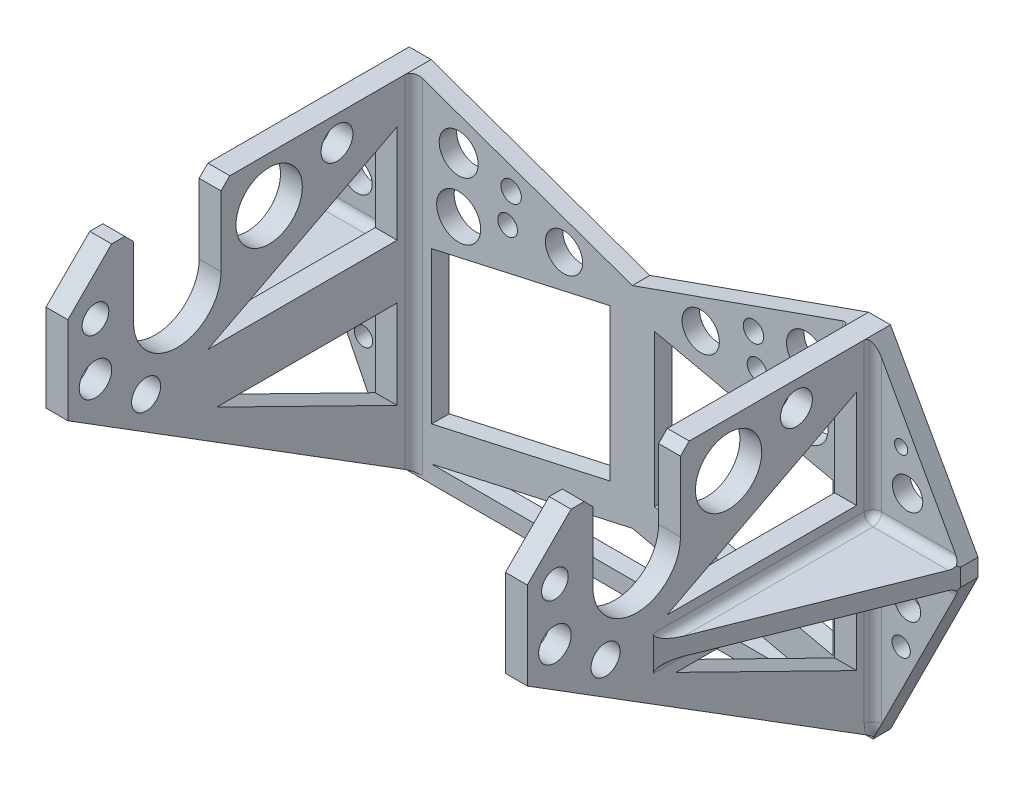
SolidWorks part; units mm, degrees
ref_plane "Plan de face" through (0, 0, 0) normal (0, 0, 1) x (1, 0, 0)
ref_plane "Plan de dessus" through (0, 0, 0) normal (0, 1, 0) x (1, 0, 0)
ref_plane "Plan de droite" through (0, 0, 0) normal (1, 0, 0) x (0, 0, -1)
sketch "Esquisse1" plane through (0, 0, 0) normal (0, 0, 1) x (1, 0, 0)
  line L0 (0, 0) -> (0, 55.457) construction
  line L1 (-55, 45.5467) -> (55, 45.5467)
  line L2 (-55, 45.5467) -> (-55, -34.4533)
  line L3 (-55, -34.4533) -> (55, -34.4533)
  line L4 (55, 45.5467) -> (55, -34.4533)
  dimension "D1" = 110
  dimension "D2" = 80
extrude "Boss.-Extru.1" add sketch "Esquisse1" along normal blind 3
sketch "Esquisse2" plane through (0, 0, 3) normal (0, 0, 1) x (1, 0, 0)
  line L0 (-55, -34.4533) -> (55, -34.4533) construction
  line L1 (-55, 45.5467) -> (-50, 45.5467)
  line L2 (-55, 45.5467) -> (-55, -34.4533)
  line L3 (-55, -34.4533) -> (-50, -34.4533)
  line L4 (-50, 45.5467) -> (-50, -34.4533)
  line L5 (0, 0) -> (0, 45.5467) construction
  line L6 (55, 45.5467) -> (-55, 45.5467) construction
  line L7 (50, 45.5467) -> (50, -34.4533)
  line L8 (55, -34.4533) -> (50, -34.4533)
  line L9 (55, 45.5467) -> (55, -34.4533)
  line L10 (55, 45.5467) -> (50, 45.5467)
  dimension "D1" = 5
extrude "Boss.-Extru.2" add sketch "Esquisse2" along normal blind 80
sketch "Esquisse3" plane through (55, 0, 0) normal (1, 0, 0) x (0, 0, -1)
  line L0 (-83, 45.5467) -> (0, 45.5467) construction
  line L2 (-3, 45.5467) -> (-3, -34.4533) construction
  circle A0 centre (-58, 27.5467) radius 10
  dimension "D1" = 20
  dimension "D2" = 18
  dimension "D3" = 55
extrude "Enlèv. mat.-Extru.1" cut sketch "Esquisse3" against normal through all
sketch "Esquisse4" plane through (55, 0, 0) normal (1, 0, 0) x (0, 0, -1)
  line L0 (-83, 45.5467) -> (0, 45.5467) construction
  line L1 (-68, 27.5467) -> (-48, 27.5467)
  line L2 (-68, 27.5467) -> (-68, 45.5467)
  line L3 (-68, 45.5467) -> (-48, 45.5467)
  line L4 (-48, 27.5467) -> (-48, 45.5467)
  circle A0 centre (-58, 27.5467) radius 10 construction
extrude "Enlèv. mat.-Extru.2" cut sketch "Esquisse4" against normal through all
chamfer "Chanfrein1" distance 10 angle 45 2 edges at (-52.5, 45.5467, 83) (52.5, 45.5467, 83)
sketch "Esquisse5" plane through (55, 0, 0) normal (1, 0, 0) x (0, 0, -1)
  line L0 (-83, 15.5467) -> (-3, -34.4533)
  line L1 (-83, -34.4533) -> (-83, 35.5467) construction
  line L2 (-83, -34.4533) -> (0, -34.4533) construction
  line L3 (-48, 45.5467) -> (0, 45.5467) construction
  line L4 (-83, 15.5467) -> (-83, -34.4533)
  line L5 (-83, -34.4533) -> (-3, -34.4533)
  dimension "D1" = 30
extrude "Enlèv. mat.-Extru.4" cut sketch "Esquisse5" against normal through all
sketch "Esquisse6" plane through (0, 0, 0) normal (0, 0, -1) x (-1, 0, 0)
  line L0 (-55, -34.4533) -> (-55, 45.5467) construction
  line L1 (-75, 45.5467) -> (75, 45.5467)
  line L2 (-75, 45.5467) -> (-75, -34.4533)
  line L3 (-75, -34.4533) -> (75, -34.4533)
  line L4 (75, 45.5467) -> (75, -34.4533)
  line L5 (0, 0) -> (0, 50.2491) construction
  line L6 (-55, 45.5467) -> (55, 45.5467) construction
  line L7 (55, -34.4533) -> (-55, -34.4533) construction
  dimension "D1" = 20
extrude "Boss.-Extru.3" add sketch "Esquisse6" against normal blind 4
ref_plane "Plan1" through (0, 5.5467, 0) normal (0, 1, 0) x (1, 0, 0)
sketch "Esquisse8" plane through (0, 5.5467, 0) normal (0, 1, 0) x (1, 0, 0)
  line L0 (75, -4) -> (55, -4)
  line L1 (55, -4) -> (55, -54.1829)
  line L2 (55, -54.1829) -> (75, -4)
extrude "Boss.-Extru.4" add sketch "Esquisse8" along normal blind 4
sketch "Esquisse9" plane through (0, 0, 4) normal (0, 0, 1) x (1, 0, 0)
  line L0 (75, 9.5467) -> (55, 45.5467)
  line L1 (55, 45.5467) -> (75, 45.5467)
  line L2 (75, 45.5467) -> (75, 9.5467)
  line L3 (75, 5.5467) -> (55, -34.4533)
  line L4 (55, -34.4533) -> (75, -34.4533)
  line L5 (75, -34.4533) -> (75, 5.5467)
  line L6 (75, -34.4533) -> (-75, -34.4533) construction
  point P10 (0, 0)
  point P13 (0, 0)
  point P14 (0, 0)
  point P15 (55, -34.4533)
extrude "Enlèv. mat.-Extru.5" cut sketch "Esquisse9" against normal blind 4
sketch "Esquisse10" plane through (0, 0, 4) normal (0, 0, 1) x (1, 0, 0)
  line L0 (0, 0) -> (0, 45.5467) construction
  circle A0 centre (-28.5, 25.5467) radius 2.25
  circle A1 centre (28.5, 25.5467) radius 2.25
  point P9 (0, 0)
  point P10 (0, 0)
  point P11 (0, 0)
  dimension "D1" = 4.5
  dimension "D2" = 57
extrude "Enlèv. mat.-Extru.6" cut sketch "Esquisse10" against normal blind 4
sketch "Esquisse11" plane through (0, 0, 4) normal (0, 0, 1) x (1, 0, 0)
  line L0 (0, 0) -> (0, 45.5467) construction
  line L2 (-50, 45.5467) -> (0, 27.821)
  line L3 (0, 27.821) -> (50, 45.5467)
  line L4 (50, 45.5467) -> (-50, 45.5467)
  line L5 (5.0672, 21.2771) -> (45.8606, 12.1873)
  line L6 (45.8606, 12.1873) -> (45.8606, -22.5026)
  line L7 (45.8606, -22.5026) -> (5.0672, -13.4127)
  line L8 (5.0672, -13.4127) -> (5.0672, 21.2771)
  line L9 (-5.0672, -13.4127) -> (-5.0672, 21.2771)
  line L10 (-45.8606, -22.5026) -> (-5.0672, -13.4127)
  line L11 (-45.8606, 12.1873) -> (-45.8606, -22.5026)
  line L12 (-5.0672, 21.2771) -> (-45.8606, 12.1873)
  line L13 (-45.8606, -30.4513) -> (0, -20.2323)
  line L14 (0, -20.2323) -> (45.8606, -30.4513)
  line L15 (45.8606, -30.4513) -> (-45.8606, -30.4513)
  point P21 (0, 0)
extrude "Enlèv. mat.-Extru.7" cut sketch "Esquisse11" against normal blind 4
mirror "Symétrie1" about plane through (0, 0, 0) normal (1, 0, 0) of "Boss.-Extru.4", "Enlèv. mat.-Extru.5"
chamfer "Chanfrein2" distance 2 angle 45 2 edges at (-52.5, 45.5467, 68) (-52.5, 45.5467, 48)
sketch "Esquisse12" plane through (55, 0, 0) normal (1, 0, 0) x (0, 0, -1)
  line L0 (-48.9947, 1.2479) -> (-7.7427, 1.2479)
  line L1 (-7.7427, 1.2479) -> (-7.7427, -19.023)
  line L2 (-7.7427, -19.023) -> (-48.9947, 1.2479)
  line L13 (-7.7427, 36.1392) -> (-7.7427, 13.662)
  line L14 (-7.7427, 13.662) -> (-51.0252, 13.662)
  line L22 (-51.0252, 13.662) -> (-7.7427, 36.1392)
  point P6 (-8.1005, -18.8472)
  point P7 (-7.7427, 36.1392)
extrude "Enlèv. mat.-Extru.8" cut sketch "Esquisse12" against normal through all
fillet "Congé1" radius 2 14 edges at (55, -14.1408, 4) (55, 5.5467, 29.0914) (65, 5.5467, 4) (55, 9.5467, 29.0914) (65, 9.5467, 4) (55, 27.5467, 4) (-55, 5.5467, 29.0914) (-55, -14.1408, 4) (-65, 5.5467, 4) (-55, 9.5467, 29.0914) (-55, 27.5467, 4) (-65, 9.5467, 4) (-50, 5.8592, 4) (50, 5.8592, 4)
sketch "Esquisse13" plane through (0, 0, 4) normal (0, 0, 1) x (1, 0, 0)
  line L0 (0, 0) -> (0, 45.4502) construction
  circle A0 centre (62.9172, 18.109) radius 3.4628
  circle A1 centre (62.9172, -4.0598) radius 2.9858
  circle A2 centre (39.6927, 21.5718) radius 5.0288
  circle A3 centre (39.6927, 34.155) radius 4.4538
  circle A4 centre (15.6237, 26.6006) radius 4.2593
  circle A5 centre (61.4393, -12.9274) radius 2.0901
  circle A6 centre (61.4393, 26.6006) radius 1.5081
  circle A7 centre (27.6907, 32.6176) radius 2.3259
  circle A8 centre (-27.6907, 32.6176) radius 2.3259
  circle A9 centre (-61.4393, 26.6006) radius 1.5081
  circle A10 centre (-61.4393, -12.9274) radius 2.0901
  circle A11 centre (-15.6237, 26.6006) radius 4.2593
  circle A12 centre (-39.6927, 34.155) radius 4.4538
  circle A13 centre (-39.6927, 21.5718) radius 5.0288
  circle A14 centre (-62.9172, -4.0598) radius 2.9858
  circle A15 centre (-62.9172, 18.109) radius 3.4628
extrude "Enlèv. mat.-Extru.9" cut sketch "Esquisse13" against normal through all
sketch "Esquisse14" plane through (55, 0, 0) normal (1, 0, 0) x (0, 0, -1)
  circle A0 centre (-21.4961, 39.8002) radius 3.6396
  circle A1 centre (-36.994, 35.1008) radius 7.5792
  circle A2 centre (-76.6982, 32.588) radius 3.0495
  circle A3 centre (-76.6982, 20.6664) radius 3.7097
  circle A4 centre (-65.1222, 11.8548) radius 3.3189
extrude "Enlèv. mat.-Extru.10" cut sketch "Esquisse14" against normal through all
